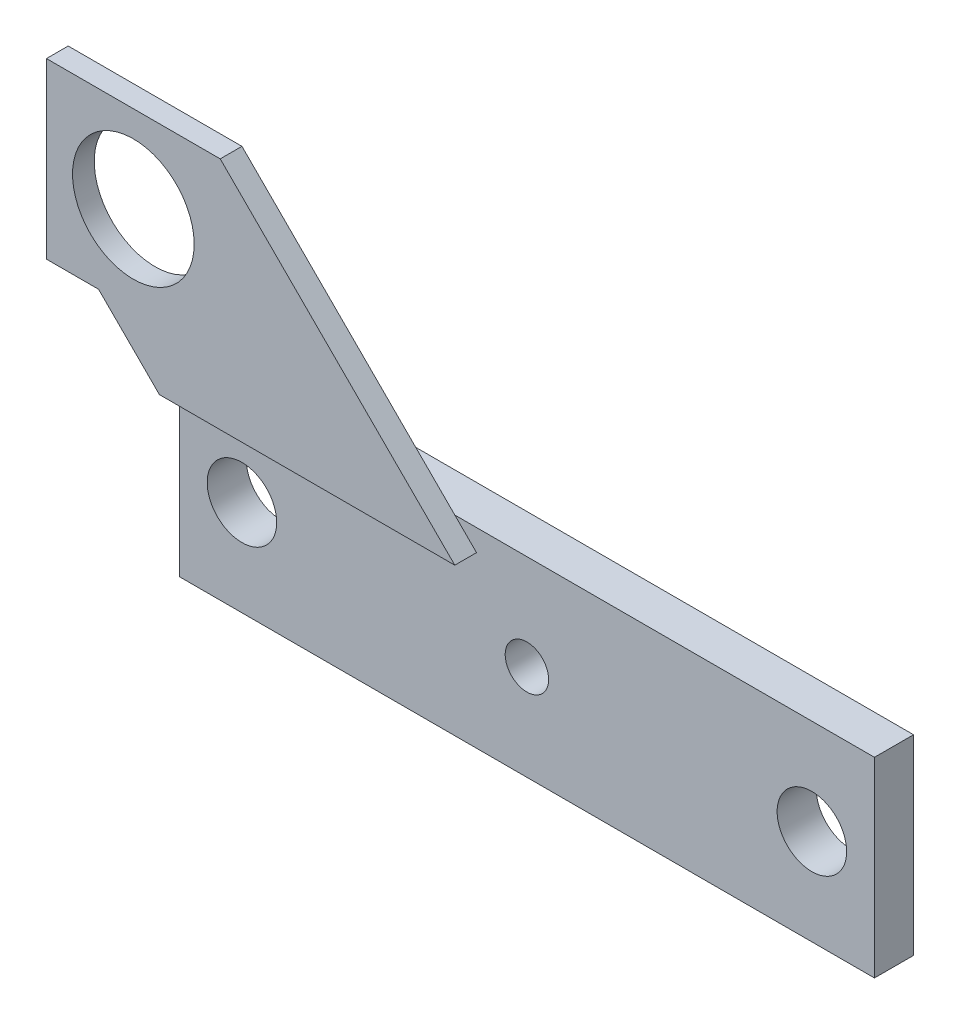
SolidWorks part; units mm, degrees
ref_plane "Plan de face" through (0, 0, 0) normal (0, 0, 1) x (1, 0, 0)
ref_plane "Plan de dessus" through (0, 0, 0) normal (0, 1, 0) x (1, 0, 0)
ref_plane "Plan de droite" through (0, 0, 0) normal (1, 0, 0) x (0, 0, -1)
sketch "Esquisse1" plane through (0, 0, 0) normal (0, 0, 1) x (1, 0, 0)
  line L0 (5, 5) -> (-5, -5) construction
  line L1 (-5, 5) -> (5, 5)
  line L2 (-5, 5) -> (-5, -5)
  line L3 (5, 5) -> (18.5, -8.5)
  line L4 (18.5, -8.5) -> (1.5, -8.5)
  line L5 (1.5, -8.5) -> (-2, -5)
  line L6 (-2, -5) -> (-5, -5)
  circle A0 centre (0, 0) radius 3.5
  dimension "D1" = 7
  dimension "D2" = 5
  dimension "D3" = 45
  dimension "D4" = 17
  dimension "D5" = 8.5
extrude "Boss.-Extru.1" add sketch "Esquisse1" along normal blind 1.25
sketch "Esquisse3" plane through (0, 0, 0) normal (0, 0, -1) x (-1, 0, 0)
  line L0 (-1.4, -7.25) -> (-41.4, -18.25) construction
  line L1 (-1.4, -7.25) -> (-41.4, -7.25)
  line L2 (-1.4, -7.25) -> (-1.4, -18.25)
  line L3 (-1.4, -18.25) -> (-41.4, -18.25)
  line L4 (-41.4, -7.25) -> (-41.4, -18.25)
  circle A2 centre (-21.4, -12.75) radius 1.25
  circle A3 centre (-5, -12.75) radius 2
  circle A4 centre (-37.8, -12.75) radius 2
  circle A6 centre (-21.4, -12.75) radius 1.25 construction
  circle A7 centre (-5, -12.75) radius 2 construction
  circle A8 centre (-37.8, -12.75) radius 2 construction
  dimension "D3" = 4
  dimension "D1" = 11
  dimension "D2" = 40
extrude "Boss.-Extru.2" add sketch "Esquisse3" along normal offset from surface (2.25 mm away) 2
sketch "Esquisse4" plane through (0, 0, -2.25) normal (0, 0, -1) x (-1, 0, 0)
  circle A0 centre (-21.4, -12.75) radius 1.25 construction
  circle A1 centre (-21.4, -12.75) radius 1.25
  circle A2 centre (-21.4, -12.75) radius 3.25
  dimension "D1" = 2
extrude "Boss.-Extru.3" add sketch "Esquisse4" along normal up to surface (2 mm away)
